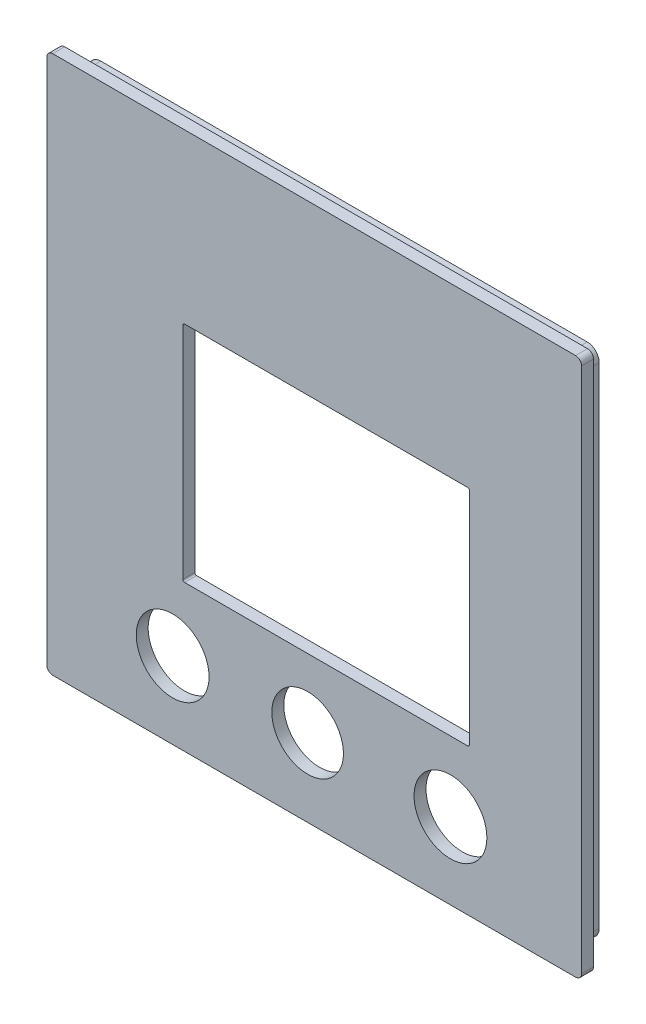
SolidWorks part; units mm, degrees
ref_plane "Front Plane" through (0, 0, 0) normal (0, 0, 1) x (1, 0, 0)
ref_plane "Top Plane" through (0, 0, 0) normal (0, 1, 0) x (1, 0, 0)
ref_plane "Right Plane" through (0, 0, 0) normal (1, 0, 0) x (0, 0, -1)
sketch "Sketch1" plane through (0, 0, 0) normal (0, 0, 1) x (1, 0, 0)
  line L0 (-70.1557, -86.9276) -> (-70.1557, -84.3959)
  line L1 (-108.975, -18.2442) -> (-27.375, -18.2442)
  line L2 (-108.975, -18.2442) -> (-108.975, -100.4442)
  line L3 (-108.975, -100.4442) -> (-27.375, -100.4442)
  line L4 (-27.375, -18.2442) -> (-27.375, -100.4442)
  line L5 (-96.375, -42.6242) -> (-42.375, -42.6242) construction
  line L6 (-96.375, -42.6242) -> (-96.375, -79.7242) construction
  line L7 (-96.375, -79.7242) -> (-42.375, -79.7242) construction
  line L8 (-42.375, -42.6242) -> (-42.375, -79.7242) construction
  line L9 (-70.1557, -99.3645) -> (-68.7812, -99.3645)
  line L10 (-70.1557, -99.3645) -> (-70.1557, -96.8327)
  line L11 (-70.1557, -84.3959) -> (-68.7812, -84.3959)
  line L12 (-68.7812, -99.3645) -> (-68.7812, -96.8327)
  line L13 (-70.1557, -99.3645) -> (-69.9256, -96.8592) construction
  line L14 (-70.1557, -84.3959) -> (-69.9256, -86.9011) construction
  line L15 (-77.0359, -92.5819) -> (-74.4189, -92.5819)
  line L17 (-77.0359, -91.1784) -> (-74.4189, -91.1784)
  line L19 (-77.0366, -92.5751) -> (-74.4475, -92.3374) construction
  line L20 (-42.175, -42.4242) -> (-96.575, -42.4242)
  line L21 (-96.575, -42.4242) -> (-96.575, -79.9242)
  line L22 (-96.575, -79.9242) -> (-42.175, -79.9242)
  line L23 (-42.175, -79.9242) -> (-42.175, -42.4242)
  line L24 (-77.0366, -91.1852) -> (-74.4475, -91.423) construction
  line L25 (-69.5599, -90.8844) -> (-69.377, -92.876) construction
  line L26 (-69.0112, -86.9011) -> (-68.7812, -84.3959) construction
  line L27 (-68.7812, -86.9276) -> (-68.7812, -84.3959)
  line L28 (-70.1808, -91.1784) -> (-68.756, -91.1784)
  line L29 (-70.4642, -91.7887) -> (-68.4726, -91.9716) construction
  line L30 (-70.4642, -91.9716) -> (-68.4726, -91.7887) construction
  line L31 (-70.1808, -92.5819) -> (-68.756, -92.5819)
  line L32 (-64.5179, -91.1784) -> (-61.9009, -91.1784)
  line L33 (-64.4894, -91.423) -> (-61.9003, -91.1852) construction
  line L34 (-64.4894, -92.3374) -> (-61.9003, -92.5751) construction
  line L35 (-64.5179, -92.5819) -> (-61.9009, -92.5819)
  line L36 (-68.7812, -92.6066) -> (-68.7812, -91.1538)
  line L37 (-69.0112, -96.8592) -> (-68.7812, -99.3645) construction
  line L38 (-69.5599, -92.876) -> (-69.377, -90.8844) construction
  line L39 (-70.1557, -92.6066) -> (-70.1557, -91.1538)
  circle A0 centre (-91.8933, -91.5775) radius 6.1
  circle A1 centre (-45.3451, -91.6535) radius 6.1
  arc A2 (-76.4331, -91.1784) -> (-76.4391, -91.2401) centre (-69.4684, -91.8802) ccw
  arc A3 (-74.4189, -91.1784) -> (-74.4189, -92.5819) centre (-69.4684, -91.8802) ccw
  arc A4 (-75.4272, -91.1784) -> (-75.4433, -91.3315) centre (-69.4684, -91.8802) ccw
  circle A5 centre (-69.4684, -91.8802) radius 1
  arc A6 (-77.0359, -91.1784) -> (-77.0359, -92.5819) centre (-69.4684, -91.8802) ccw
  circle A7 centre (-69.4684, -91.8802) radius 5 construction
  circle A8 centre (-69.4684, -91.8802) radius 6 construction
  circle A9 centre (-69.4684, -91.8802) radius 7 construction
  circle A10 centre (-69.4684, -91.8802) radius 7.6 construction
  arc A11 (-68.7812, -86.9276) -> (-70.1557, -86.9276) centre (-69.4684, -91.8802) ccw
  arc A14 (-64.5179, -92.5819) -> (-64.5179, -91.1784) centre (-69.4684, -91.8802) ccw
  arc A15 (-63.5096, -92.5819) -> (-63.4936, -92.4288) centre (-69.4684, -91.8802) ccw
  arc A16 (-62.5037, -92.5819) -> (-62.4977, -92.5203) centre (-69.4684, -91.8802) ccw
  arc A17 (-61.9009, -92.5819) -> (-61.9009, -91.1784) centre (-69.4684, -91.8802) ccw
  arc A18 (-70.1557, -96.8327) -> (-68.7812, -96.8327) centre (-69.4684, -91.8802) ccw
  arc A21 (-75.4433, -92.4288) -> (-75.4272, -92.5819) centre (-69.4684, -91.8802) ccw
  arc A22 (-76.4391, -92.5203) -> (-76.4331, -92.5819) centre (-69.4684, -91.8802) ccw
  arc A23 (-63.4936, -91.3315) -> (-63.5096, -91.1784) centre (-69.4684, -91.8802) ccw
  arc A24 (-62.4977, -91.2401) -> (-62.5037, -91.1784) centre (-69.4684, -91.8802) ccw
  dimension "D1" = 12.2
  dimension "D2" = 12.2
  dimension "D5" = 2
  dimension "D6" = 10
  dimension "D3" = 2
  dimension "D4" = 1
  dimension "D8" = 0.6
extrude "Boss-Extrude1" add sketch "Sketch1" along normal blind 2 contours L4 L1 L2 L3 A17 L35 A14 L32 A6 L17 A3 L15 A5 A1 A0 L23 L22 L21 L20 L27 A11 L0 L11 L10 A18 L12 L9
fillet "Fillet1" radius 0.3 4 edges at (-96.575, -79.9242, 1) (-42.175, -79.9242, 1) (-42.175, -42.4242, 1) (-96.575, -42.4242, 1)
sketch "Sketch2" plane through (0, 0, 0) normal (0, 0, -1) x (-1, 0, 0)
  line L1 (27.375, -18.2442) -> (108.975, -18.2442) construction
  line L2 (27.375, -18.2442) -> (27.375, -100.4442) construction
  line L3 (27.375, -100.4442) -> (108.975, -100.4442) construction
  line L4 (108.975, -18.2442) -> (108.975, -100.4442) construction
  line L8 (107.775, -19.4442) -> (107.775, -99.2442)
  line L9 (28.575, -99.2442) -> (107.775, -99.2442)
  line L10 (28.575, -19.4442) -> (28.575, -99.2442)
  line L11 (28.575, -19.4442) -> (107.775, -19.4442)
  line L12 (27.175, -18.0442) -> (27.175, -100.6442)
  line L13 (27.175, -100.6442) -> (109.175, -100.6442)
  line L14 (109.175, -100.6442) -> (109.175, -18.0442)
  line L15 (109.175, -18.0442) -> (27.175, -18.0442)
  line L16 (27.175, -18.0442) -> (27.175, -100.6442)
  line L17 (27.175, -100.6442) -> (109.175, -100.6442)
  line L18 (109.175, -100.6442) -> (109.175, -18.0442)
  line L19 (109.175, -18.0442) -> (27.175, -18.0442)
  dimension "D1" = 0.2
  dimension "D2" = 1.2
extrude "Boss-Extrude2" add sketch "Sketch2" along normal blind 3
sketch "Sketch3" plane through (0, 0, 2) normal (0, 0, 1) x (1, 0, 0)
  circle A0 centre (-69.275, -91.4442) radius 6
extrude "Cut-Extrude1" cut sketch "Sketch3" against normal blind 3
sketch "Sketch4" plane through (0, 0, 2) normal (0, 0, 1) x (1, 0, 0)
  circle A0 centre (-69.275, -91.4442) radius 6
  circle A1 centre (-69.275, -91.4442) radius 8.1771
extrude "Boss-Extrude3" add sketch "Sketch4" against normal up to surface (2 mm away)
sketch "Sketch5" plane through (0, 0, 2) normal (0, 0, 1) x (1, 0, 0)
  line L0 (-112.975, -14.2442) -> (-112.975, -104.4442)
  line L1 (-108.975, -18.2442) -> (-27.375, -18.2442)
  line L2 (-108.975, -18.2442) -> (-108.975, -100.4442)
  line L3 (-108.975, -100.4442) -> (-27.375, -100.4442)
  line L4 (-27.375, -18.2442) -> (-27.375, -100.4442)
  line L5 (-112.975, -104.4442) -> (-23.375, -104.4442)
  line L6 (-23.375, -14.2442) -> (-23.375, -104.4442)
  line L7 (-112.975, -14.2442) -> (-23.375, -14.2442)
  dimension "D1" = 4
extrude "Boss-Extrude4" add sketch "Sketch5" against normal blind 2
sketch "Sketch6" plane through (0, 0, 2) normal (0, 0, 1) x (1, 0, 0)
  line L0 (-42.475, -42.4242) -> (-96.275, -42.4242) construction
  line L1 (-96.175, -42.4242) -> (-96.8293, -42.4242)
  line L2 (-96.175, -42.4242) -> (-96.175, -80.5379)
  line L3 (-96.175, -80.5379) -> (-96.8293, -80.5379)
  line L4 (-96.8293, -42.4242) -> (-96.8293, -80.5379)
  line L5 (-96.175, -79.5242) -> (-96.175, -42.4242) construction
extrude "Boss-Extrude5" add sketch "Sketch6" against normal blind 2
sketch "Sketch7" plane through (0, 0, 2) normal (0, 0, 1) x (1, 0, 0)
  line L0 (-96.175, -79.9242) -> (-42.475, -79.9242) construction
  line L1 (-96.175, -42.4242) -> (-90.175, -42.4242)
  line L2 (-96.175, -42.4242) -> (-96.175, -79.9242)
  line L3 (-96.175, -79.9242) -> (-90.175, -79.9242)
  line L4 (-90.175, -42.4242) -> (-90.175, -79.9242)
  dimension "D1" = 6
extrude "Boss-Extrude6" add sketch "Sketch7" against normal up to surface (2 mm away)
fillet "Fillet2" radius 0.3 2 edges at (-90.175, -42.4242, 1) (-90.175, -79.9242, 1)
fillet "Fillet3" radius 1 4 edges at (-112.975, -14.2442, 1) (-23.375, -14.2442, 1) (-112.975, -104.4442, 1) (-23.375, -104.4442, 1)
sketch "Sketch8" plane through (0, 0, -3) normal (0, 0, -1) x (-1, 0, 0)
  line L1 (27.175, -18.0442) -> (109.175, -18.0442)
  line L2 (27.175, -18.0442) -> (27.175, -100.6442)
  line L3 (27.175, -100.6442) -> (109.175, -100.6442)
  line L4 (109.175, -18.0442) -> (109.175, -100.6442)
extrude "Cut-Extrude2" cut sketch "Sketch8" against normal up to surface (3 mm away)
sketch "Sketch9" plane through (0, 0, 0) normal (0, 0, -1) x (-1, 0, 0)
  line L0 (23.375, -103.4442) -> (23.375, -15.2442) construction
  line L1 (27.425, -16.2942) -> (108.925, -16.2942)
  line L2 (25.425, -18.2942) -> (25.425, -100.3942)
  line L3 (27.425, -102.3942) -> (108.925, -102.3942)
  line L4 (110.925, -18.2942) -> (110.925, -100.3942)
  line L5 (112.975, -15.2442) -> (112.975, -103.4442) construction
  line L6 (111.975, -104.4442) -> (24.375, -104.4442) construction
  line L7 (24.375, -14.2442) -> (111.975, -14.2442) construction
  line L8 (27.425, -17.7942) -> (108.925, -17.7942)
  line L9 (109.425, -18.2942) -> (109.425, -100.3942)
  line L10 (27.425, -100.8942) -> (108.925, -100.8942)
  line L11 (26.925, -18.2942) -> (26.925, -100.3942)
  arc A0 (108.925, -16.2942) -> (110.925, -18.2942) centre (108.925, -18.2942) cw
  arc A1 (108.925, -102.3942) -> (110.925, -100.3942) centre (108.925, -100.3942) ccw
  arc A2 (25.425, -100.3942) -> (27.425, -102.3942) centre (27.425, -100.3942) ccw
  arc A3 (27.425, -16.2942) -> (25.425, -18.2942) centre (27.425, -18.2942) ccw
  arc A4 (108.925, -17.7942) -> (109.425, -18.2942) centre (108.925, -18.2942) cw
  arc A5 (108.925, -100.8942) -> (109.425, -100.3942) centre (108.925, -100.3942) ccw
  arc A6 (26.925, -100.3942) -> (27.425, -100.8942) centre (27.425, -100.3942) ccw
  arc A7 (27.425, -17.7942) -> (26.925, -18.2942) centre (27.425, -18.2942) ccw
  dimension "D5" = 2
  dimension "D1" = 2.05
  dimension "D2" = 2.05
  dimension "D3" = 2.05
  dimension "D4" = 2.05
  dimension "D6" = 1.5
extrude "Boss-Extrude7" add sketch "Sketch9" along normal blind 3
